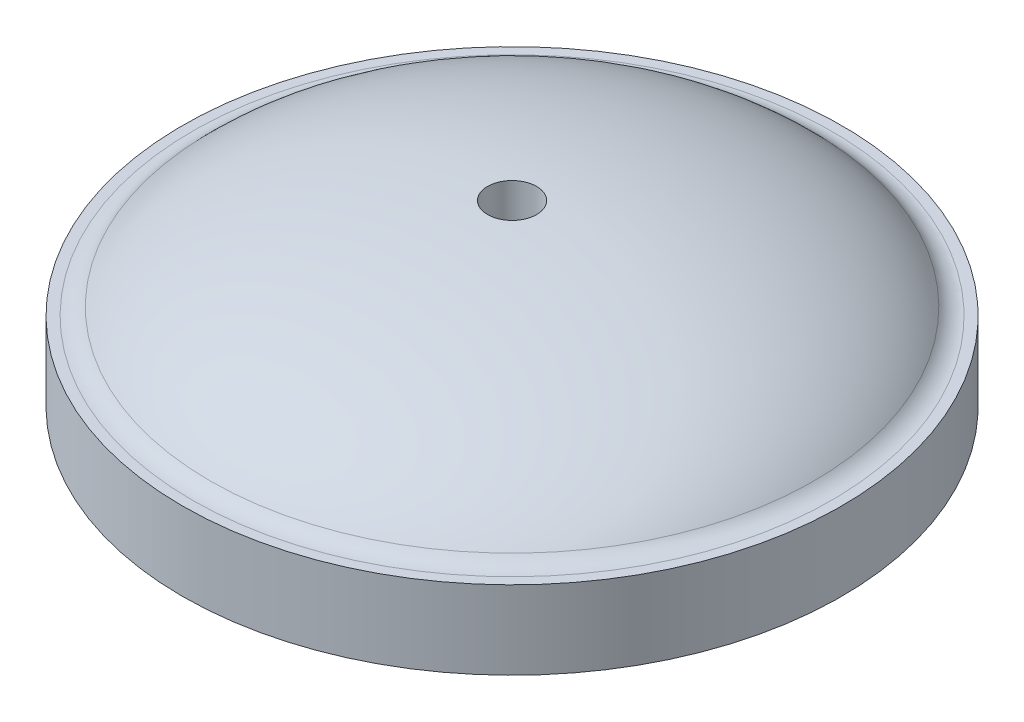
SolidWorks part; units mm, degrees
ref_plane "Plane1" through (0, 0, 0) normal (0, 0, 1) x (1, 0, 0)
ref_plane "Plane2" through (0, 0, 0) normal (0, 1, 0) x (1, 0, 0)
ref_plane "Plane3" through (0, 0, 0) normal (1, 0, 0) x (0, 0, -1)
sketch "Sketch2" plane through (0, 0, 0) normal (0, 0, 1) x (1, 0, 0)
  line L0 (-92.202, 0) -> (106.172, 0) construction
  line L1 (0, 86.36) -> (0, -75.946) construction
  line L2 (15.875, 33.1582) -> (15.875, 5.9944)
  line L4 (8.2296, 6.5024) -> (12.7, 6.5024) construction
  line L5 (71.5, 9.9101) -> (71.5, 5.9944)
  line L6 (71.5, 6.5024) -> (78.74, 6.5024) construction
  line L8 (82.55, -6.1976) -> (82.55, 5.9944)
  line L11 (3.5552, 5.9944) -> (2.8174, 37.4525)
  line L15 (2.65, 40.9956) -> (12.7, 40.9956) construction
  line L17 (15.875, 5.9944) -> (3.5552, 5.9944)
  line L18 (82.9379, 14.1224) -> (85.5161, 14.1224)
  line L19 (82.55, 6.246) -> (82.55, -20.574) construction
  line L20 (82.55, -6.1976) -> (85.5161, -6.1976)
  line L21 (71.5, 5.9944) -> (82.55, 5.9944)
  line L30 (85.5161, 14.1224) -> (85.5161, -6.1976)
  arc A0 (71.5, 9.9101) -> (64.5047, 21.2567) centre (58.8, 9.9101) ccw
  arc A1 (2.8174, 37.4525) -> (5.4326, 40.0509) centre (5.3567, 37.5121) cw
  arc A10 (78.301, 16.1341) -> (82.9379, 14.1224) centre (82.9379, 20.4724) ccw
  ellipse E0 centre (0, 0) end of major axis (85.5161, 0) minor radius 40.132 (78.301, 16.1341) -> (5.4326, 40.0509) ccw
  ellipse E2 centre (0, 0) end of major axis (82.9945, 0) minor radius 33.782 (64.5047, 21.2567) -> (15.875, 33.1582) ccw
  point P19 (82.55, 5.9944)
  point P59 (2.413, 30.0736)
  point P63 (3.556, 21.2344)
  dimension "D11" = 12.7
  dimension "D36" = 6.35
  dimension "D9" = 2.54
  dimension "D1" = 40.132
  dimension "D4" = 165.989
  dimension "D5" = 6.5024
  dimension "D6" = 6.35
  dimension "D7" = 143
  dimension "D8" = 2.9661
  dimension "D12" = 3.9157
  dimension "D13" = 27.1638
  dimension "D16" = 40.9956
  dimension "D17" = 5.3
  dimension "D21" = 82.55
  dimension "D22" = 12.7
  dimension "D24" = 0.508
  dimension "D27" = 34.4932
  dimension "D28" = 31.75
  dimension "D30" = 15.24
  dimension "D34" = 7.62
revolve "Base-Revolve" add sketch "Sketch2" angle 360 about L1
ref_plane "Plane7" through (0, 7.5184, 0) normal (0, -1, 0) x (1, 0, 0)
sketch "Sketch3" plane through (0, 5.9944, 0) normal (0, -1, 0) x (1, 0, 0)
  line L0 (-50.4825, 50.6336) -> (-10.745, 11.6859)
  line L3 (-78.4852, 76.9253) -> (77.1932, -75.659) construction
  line L16 (-51.6367, 49.456) -> (-11.8992, 10.5083)
  arc A2 (-10.745, 11.6859) -> (-11.8992, 10.5083) centre (0, 0) ccw
  circle A4 centre (0, 0) radius 15.875 construction
  circle A8 centre (0, 0) radius 71.5 construction
  arc A9 (-51.6367, 49.456) -> (-50.4825, 50.6336) centre (0, 0) cw
  dimension "D1" = 1.6489
extrude "Ribs Extrude" add sketch "Sketch3" against normal up to surface (11.1585 mm away)
pattern_circular "CirPattern1" count 5 over 360 about axis through (0, 0, 0) along (0, 1, 0) of "Ribs Extrude"
sketch "Sketch6" plane through (0, 5.9944, 0) normal (0, -1, 0) x (1, 0, 0)
  circle A1 centre (0, 0) radius 6.35
extrude "Cut-Extrude1" cut sketch "Sketch6" against normal through all
sketch "Sketch7" plane through (0, 5.9944, 0) normal (0, -1, 0) x (1, 0, 0)
  circle A2 centre (0, 0) radius 77.47
  circle A3 centre (0, 0) radius 77.47
  dimension "D1" = 5.08
fillet "Fillet1" radius 1.524 45 edges at (70.8445, 7.9523, -9.6595) (69.6996, 15.207, -9.4899) (31.0788, 7.9523, 64.3922) (30.5638, 15.207, 63.3557) (-63.7554, 7.9523, -32.3651) (-61.2888, 17.8431, -31.0769) (11.0795, 7.9523, -70.6364) (10.6166, 17.8431, -67.8924) (12.7055, 7.9523, -70.3621) (12.5129, 15.207, -69.2208) (70.6029, 7.9523, -11.2906) (67.8503, 17.8431, -10.8829) (-62.9921, 7.9523, -33.8267) (-61.9661, 15.207, -33.2909) (32.5555, 7.9523, 63.6584) (31.3171, 17.8431, 61.1664) (-50.4825, 7.9523, 50.6336) (-48.4952, 17.8431, 48.6858) (-51.6367, 7.9523, 49.456) (-50.8101, 15.207, 48.6458) (3.4501, 19.5763, -15.4956) (15.5617, 19.5763, -3.1383) (-13.671, 19.5763, -8.0696) (1.8241, 19.5763, -15.7699) (-11.8992, 19.5763, 10.5083) (-10.745, 19.5763, 11.6859) (-14.4343, 19.5763, -6.608) (6.3169, 19.5763, 14.5641) (15.8033, 19.5763, -1.5072) (7.7936, 19.5763, 13.8303) (50.3152, 26.7306, -6.6188) (-2.6406, 33.1582, 15.6538) (21.8431, 26.7306, 45.8073) (-15.7037, 33.1582, 2.3259) (-42.0309, 27.8447, -21.0198) (7.0028, 27.8447, -46.4692) (-7.0648, 33.1582, -14.2164) (14.0717, 33.1582, 7.3487) (11.3374, 33.1582, -11.1121) (9.2534, 26.7306, -49.8979) (46.3589, 27.8447, -7.6998) (-44.5963, 26.7306, -24.2198) (21.6486, 27.8447, 41.7105) (-32.9793, 27.8447, 33.4783) (-36.8154, 26.7306, 34.9293)
